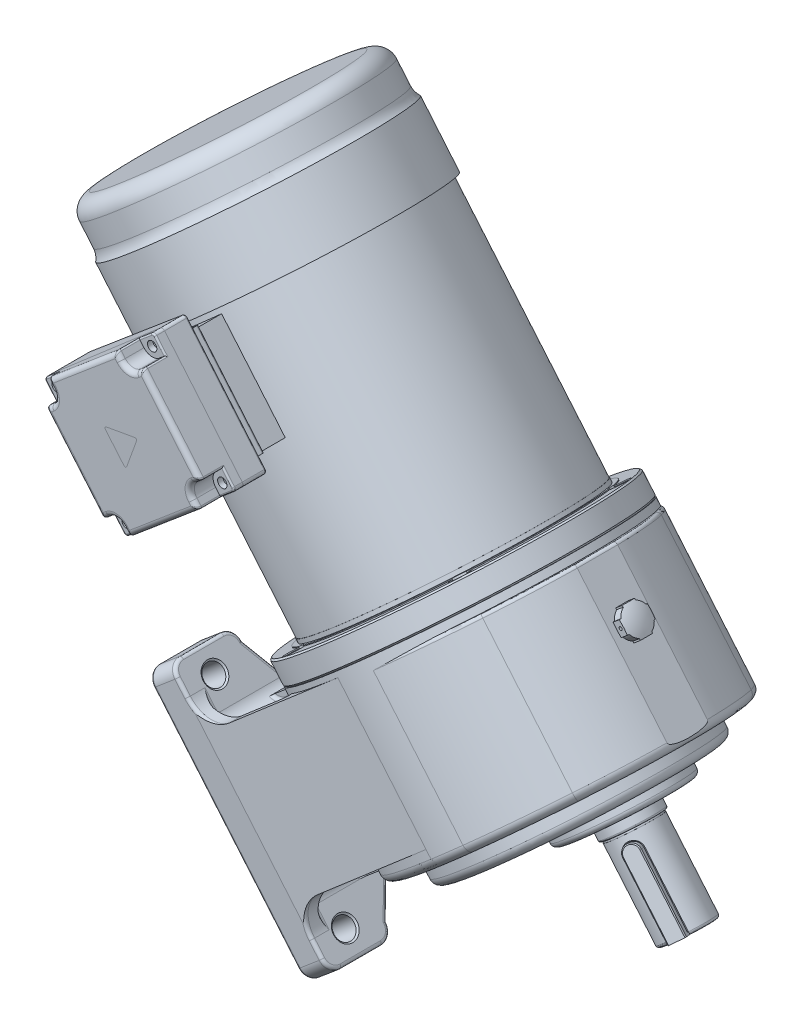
SolidWorks part; units mm, degrees
ref_plane "前视基准面" through (0, 0, 0) normal (0, 0, 1) x (1, 0, 0)
ref_plane "上视基准面" through (0, 0, 0) normal (0, 1, 0) x (1, 0, 0)
ref_plane "右视基准面" through (0, 0, 0) normal (1, 0, 0) x (0, 0, -1)
imported_body "接线盒座-1-surface1"
imported_body "接线盒座-1-surface2"
imported_body "接线盒座-1-surface3"
imported_body "接线盒座-1-surface4"
imported_body "接线盒座-1-surface5"
imported_body "接线盒盖-1-surface1"
imported_body "接线盒盖-1-surface2"
imported_body "接线盒盖-1-surface3"
imported_body "接线盒盖-1-surface4"
imported_body "接线盒盖-1-surface5"
imported_body "接线盒盖-1-surface6"
imported_body "接线盒盖-1-surface7"
imported_body "32卧式装配体2-1/32卧式箱体-1-surface1"
imported_body "32卧式装配体2-1/32卧式箱体-1-surface2"
imported_body "32卧式装配体2-1/32卧式箱体-1-surface3"
imported_body "32卧式装配体2-1/32卧式箱体-1-surface4"
imported_body "32卧式装配体2-1/32卧式箱体-1-surface5"
imported_body "32卧式装配体2-1/32卧式箱体-1-surface6"
imported_body "32卧式装配体2-1/32卧式箱体-1-surface7"
imported_body "32卧式装配体2-1/32卧式箱体-1-surface8"
imported_body "32卧式装配体2-1/32卧式箱体-1-surface9"
imported_body "32卧式装配体2-1/32卧式箱体-1-surface10"
imported_body "32卧式装配体2-1/32卧式箱体-1-surface11"
imported_body "32卧式装配体2-1/32卧式箱体-1-surface12"
imported_body "32卧式装配体2-1/32卧式箱体-1-surface13"
imported_body "32卧式装配体2-1/32卧式箱体-1-surface14"
imported_body "32卧式装配体2-1/32卧式箱体-1-surface15"
imported_body "32卧式装配体2-1/32卧式箱体-1-surface16"
imported_body "32卧式装配体2-1/C10X50-1-surface1"
imported_body "32卧式装配体2-1/透气塞-1-surface1"
sketch "草图1" plane through (63.2251, -75.039, 0) normal (-0.6443, 0.7647, 0) x (0.7647, 0.6443, 0)
  circle A0 centre (68.7059, 81.0336) radius 80
extrude "凸台-拉伸1" add sketch "草图1" along normal blind 155
sketch "草图2" plane through (-36.6477, 43.4955, 0) normal (-0.6443, 0.7647, 0) x (0.7647, 0.6443, 0)
  circle A0 centre (68.7059, 81.0336) radius 83
extrude "凸台-拉伸2" add sketch "草图2" along normal blind 39
sketch "草图3" plane through (-61.777, 73.3203, 0) normal (-0.6443, 0.7647, 0) x (0.7647, 0.6443, 0)
  circle A0 centre (68.7059, 81.0336) radius 81
extrude "凸台-拉伸3" add sketch "草图3" along normal blind 30
fillet "圆角1" radius 10 1 edges at (-90.509, 88.3408, -81.0336)
fillet "圆角2" radius 10 1 edges at (-71.1788, 65.3987, -81.0336)
